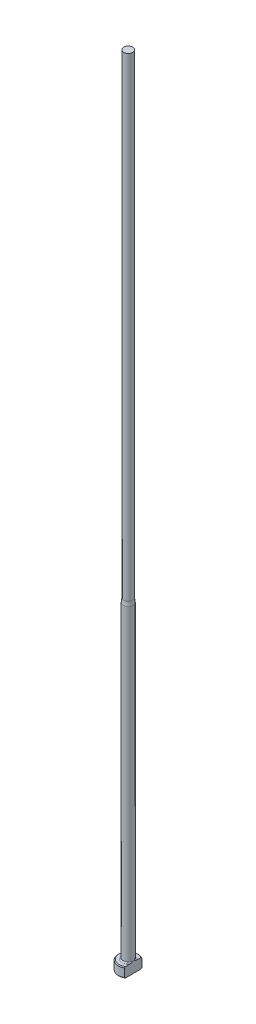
SolidWorks part; units mm, degrees
ref_plane "Front Plane" through (0, 0, 0) normal (0, 0, 1) x (1, 0, 0)
ref_plane "Top Plane" through (0, 0, 0) normal (0, 1, 0) x (1, 0, 0)
ref_plane "Right Plane" through (0, 0, 0) normal (1, 0, 0) x (0, 0, -1)
sketch "Sketch1" plane through (0, 0, 0) normal (0, 0, 1) x (1, 0, 0)
  line L0 (0, 259.9588) -> (0, -15.1925) construction
  line L1 (0, 0) -> (-3.175, 0)
  line L2 (-3.175, 0) -> (-3.175, 3.175)
  line L3 (-3.175, 3.175) -> (-1.5875, 3.175)
  line L4 (-1.4516, 102.9067) -> (-1.4516, 254)
  line L5 (-1.4516, 254) -> (0, 254)
  line L6 (0, 254) -> (0, 0)
  line L7 (-1.5875, 3.175) -> (-1.5875, 101.6)
  arc A0 (-1.5875, 101.6) -> (-1.4516, 102.9067) centre (-7.8016, 102.9067) ccw
  point P13 (-1.5875, 0)
  dimension "D1" = 6.35
  dimension "L" = 254
  dimension "D2" = 3.175
  dimension "H" = 6.35
  dimension "T" = 3.175
  dimension "D" = 2.9032
  dimension "S" = 101.6
revolve "Revolve1" add sketch "Sketch1" angle 360 about L0
chamfer "Chamfer1" distance 0.254 angle 45 2 edges at (0, 3.175, 3.175) (0, 0, 3.175)
fillet "Fillet1" radius 0.381 1 edges at (0, 3.175, 1.5875)
sketch "Sketch2" plane through (0, 0, 0) normal (0, 1, 0) x (1, 0, 0)
  line L0 (1.5875, -2.7496) -> (1.5875, 2.7496)
  circle A0 centre (0, 0) radius 3.175 construction
  arc A2 (1.5875, -2.7496) -> (1.5875, 2.7496) centre (0, 0) ccw
  circle A3 centre (0, 0) radius 3.175 construction
  circle A4 centre (0, 0) radius 1.5875 construction
extrude "Key Head" cut sketch "Sketch2" along normal up to next
